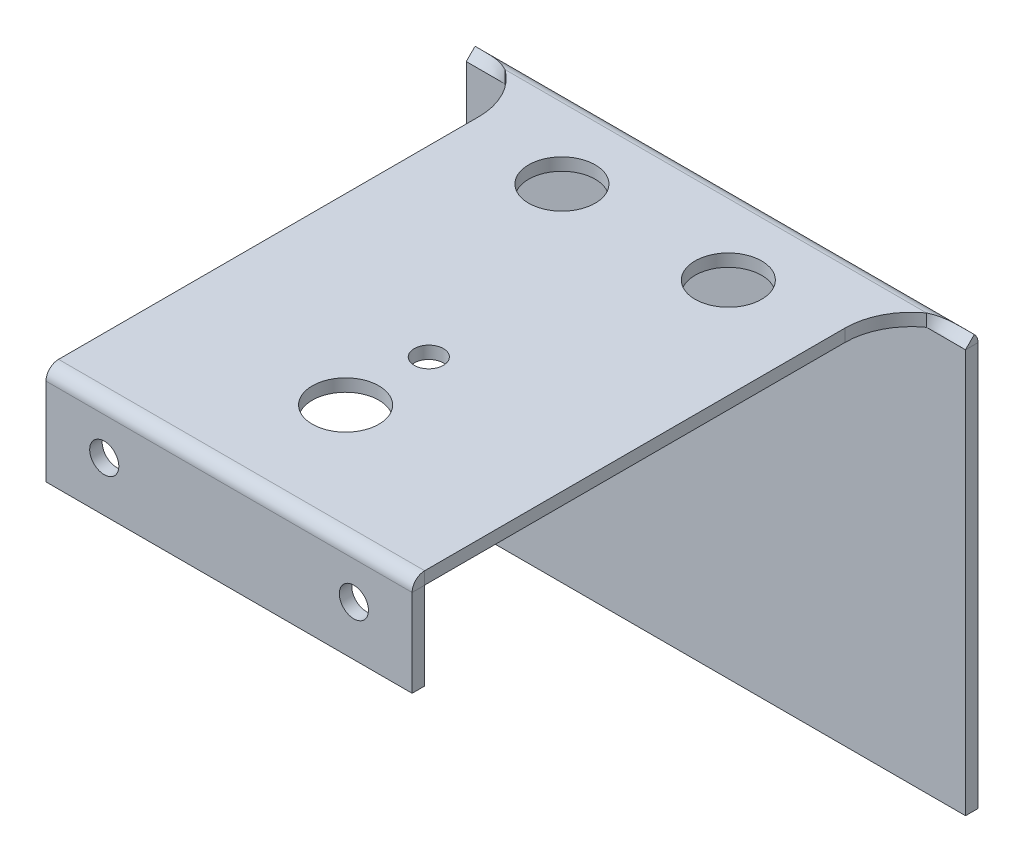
SolidWorks part; units mm, degrees
ref_plane "Front" through (0, 0, 0) normal (0, 0, 1) x (1, 0, 0)
ref_plane "Top" through (0, 0, 0) normal (0, 1, 0) x (1, 0, 0)
ref_plane "Right" through (0, 0, 0) normal (1, 0, 0) x (0, 0, -1)
sketch "Sketch1" plane through (0, 0, 0) normal (0, 1, 0) x (1, 0, 0)
  line L3 (22, 0) -> (22, 64)
  line L4 (-22, 0) -> (-22, 64)
  line L5 (30, 72) -> (30, 122)
  line L6 (-30, 72) -> (-30, 122)
  line L7 (-22, 0) -> (22, 0)
  line L9 (-30, 122) -> (30, 122)
  arc A0 (30, 72) -> (22, 64) centre (30, 64) ccw
  arc A1 (-22, 64) -> (-30, 72) centre (-30, 64) ccw
  circle A2 centre (-10, 62) radius 4
  circle A3 centre (10, 62) radius 4
  circle A4 centre (0, 36) radius 1.75
  circle A5 centre (0, 26) radius 4
  circle A6 centre (-15, 6) radius 1.75
  circle A7 centre (15, 6) radius 1.75
sheet metal parameters "Sheet-Metal1" thickness 1.5 parameters "D1"=0.01
base flange "Base-Flange1" sketch "Sketch1" thickness 1.5 reverse thickness direction yes parameters "D1"=0.01
sketch "Sketch3" plane through (0, 1.5, 0) normal (0, 1, 0) x (-1, 0, 0)
  line L0 (30, -72) -> (-30, -72)
  line L2 (-22, -12) -> (22, -12)
sketched bend "Sketched Bend2" parameters "D1"=0
bend "SketchBend2" bend radius 0.01 bend angle 90 parameters "D5"=1
bend "SketchBend3" bend radius 0 bend angle 90 parameters "D5"=2
flat pattern "Flat-Pattern1"
sketch "Bend-Lines1" plane through (0, 1.5, 0) normal (0, 1, 0) x (-1, 0, 0)
  line L0 (22, -12) -> (-22, -12) construction
  line L1 (-30, -72) -> (30, -72) construction
bend of the flat pattern "Flatten-<SketchBend2>1"
bend of the flat pattern "Flatten-<SketchBend3>1"
